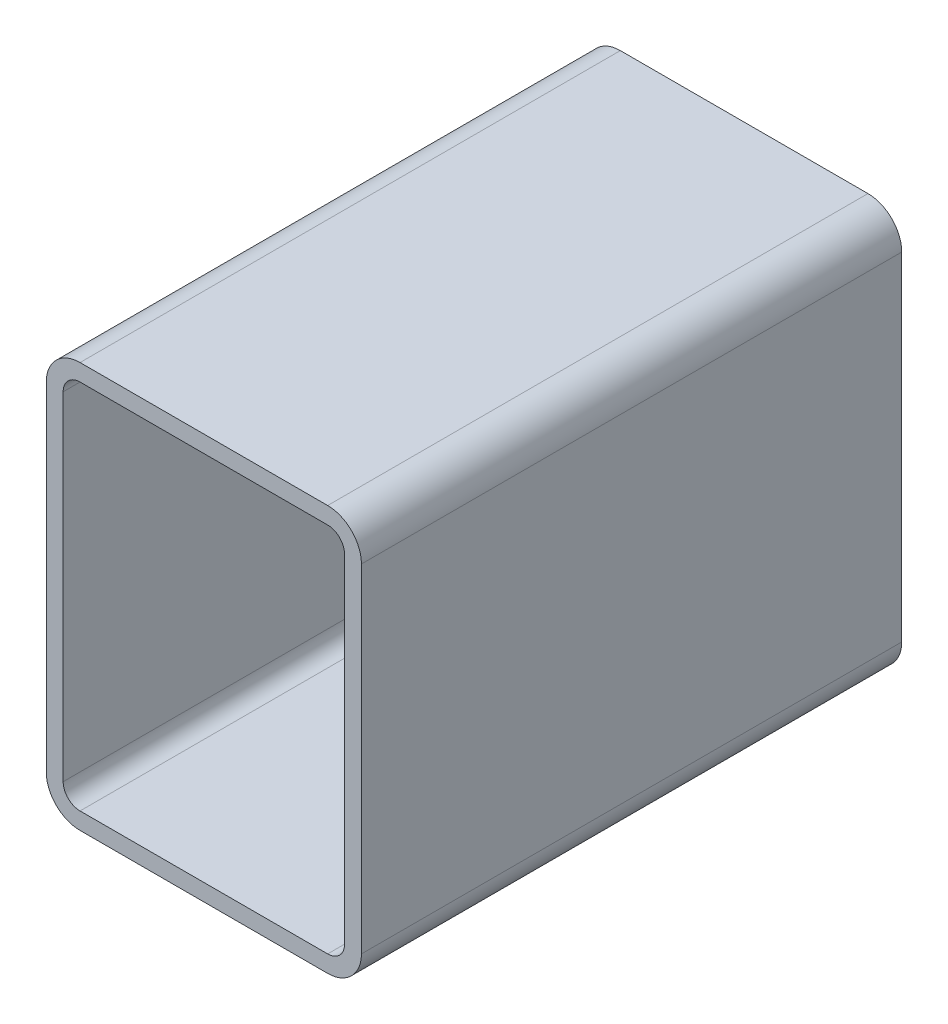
SolidWorks part; units mm, degrees
ref_plane "Front Plane" through (0, 0, 0) normal (0, 0, 1) x (1, 0, 0)
ref_plane "Top Plane" through (0, 0, 0) normal (0, 1, 0) x (1, 0, 0)
ref_plane "Right Plane" through (0, 0, 0) normal (1, 0, 0) x (0, 0, -1)
sketch "Sketch1" plane through (0, 0, 0) normal (0, 0, 1) x (1, 0, 0)
sketch_block_instance "HSS9x7x0.375-1"
sketch_block "HSS9x7x0.375"
extrude "Boss-Extrude1" add sketch "Sketch1" along normal blind 304.8
